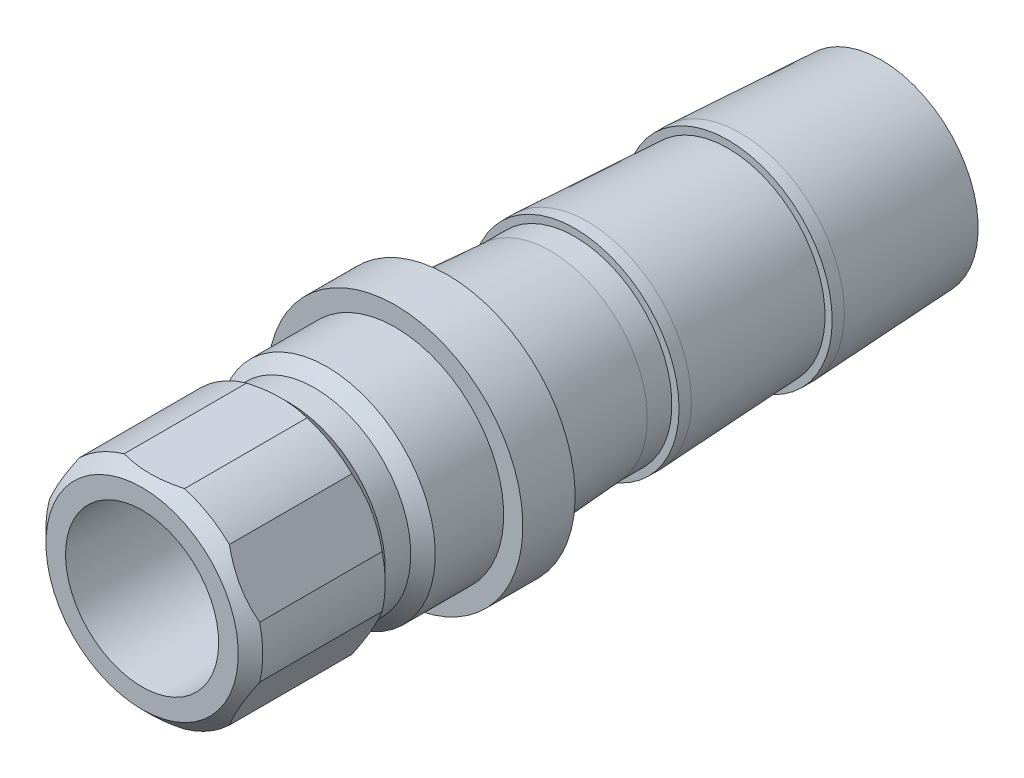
SolidWorks part; units mm, degrees
ref_plane "Front Plane" through (0, 0, 0) normal (0, 0, 1) x (1, 0, 0)
ref_plane "Top Plane" through (0, 0, 0) normal (0, 1, 0) x (1, 0, 0)
ref_plane "Right Plane" through (0, 0, 0) normal (1, 0, 0) x (0, 0, -1)
sketch "Sketch1" plane through (0, 0, 0) normal (1, 0, 0) x (0, 0, -1)
  line L0 (0, 0) -> (-18.923, 0) construction
  line L1 (-15.748, 4.7625) -> (-15.748, 5.9817)
  line L2 (-6.604, 5.9817) -> (-6.604, 0) construction
  line L3 (-14.986, 6.7437) -> (-7.366, 6.7437)
  line L4 (0, 7.9375) -> (0, 0) construction
  line L5 (-6.604, 5.9817) -> (-5.0165, 5.9817)
  line L6 (-4.2545, 6.7437) -> (0, 6.7437)
  line L7 (0, 6.7437) -> (0, 7.9375)
  line L8 (-6.604, 5.9817) -> (-7.366, 6.7437)
  line L9 (-5.0165, 5.9817) -> (-4.2545, 6.7437)
  line L10 (-15.748, 5.9817) -> (-14.986, 6.7437)
  line L11 (-15.748, 4.7625) -> (-3.556, 4.7625)
  line L12 (0, 7.9375) -> (3.2512, 7.9375)
  line L13 (21.463, 6.477) -> (20.701, 6.477)
  line L14 (30.226, 6.0325) -> (30.226, 4.3656)
  line L15 (0, 0) -> (4.445, 0) construction
  line L16 (20.701, 6.477) -> (20.701, 6.0325)
  line L17 (-0.6919, 4.3656) -> (30.226, 4.3656)
  line L18 (-3.556, 4.7625) -> (-0.6919, 4.3656)
  line L19 (30.226, 6.0325) -> (21.463, 6.477)
  line L20 (11.938, 6.477) -> (11.176, 6.477)
  line L21 (20.701, 6.0325) -> (11.938, 6.477)
  line L23 (11.176, 6.0325) -> (9.652, 6.0325)
  line L24 (9.652, 6.0325) -> (3.2512, 6.477)
  line L25 (3.2512, 6.477) -> (3.2512, 7.9375)
  line L26 (11.176, 6.477) -> (11.176, 6.0325)
  dimension "D1" = 15.748
  dimension "D2" = 1.5875
  dimension "D3" = 0.762
  dimension "D4" = 45
  dimension "D5" = 9.144
  dimension "D6" = 45
  dimension "D7" = 15.875
  dimension "D8" = 26.9748
  dimension "D9" = 45.974
  dimension "D10" = 9.525
  dimension "D11" = 9.525
  dimension "D12" = 0.762
  dimension "D13" = 12.954
  dimension "D14" = 13.4874
  dimension "D15" = 8.7312
  dimension "D16" = 12.192
  dimension "D17" = 12.065
  dimension "D18" = 1.524
revolve "Revolve1" add sketch "Sketch1" angle 360 about L0
sketch "Sketch2" plane through (0, 0, 15.748) normal (0, 0, 1) x (1, 0, 0)
  line L1 (-3.7395, 6.477) -> (-7.479, 0)
  line L2 (-7.479, 0) -> (-3.7395, -6.477)
  line L3 (-3.7395, -6.477) -> (3.7395, -6.477)
  line L4 (3.7395, -6.477) -> (7.479, 0)
  line L5 (7.479, 0) -> (3.7395, 6.477)
  line L6 (3.7395, 6.477) -> (-3.7395, 6.477)
  circle A0 centre (0, 0) radius 6.477 construction
  dimension "D1" = 12.954
extrude "Cut-Extrude1" cut sketch "Sketch2" against normal blind 9.525 flip side to cut
